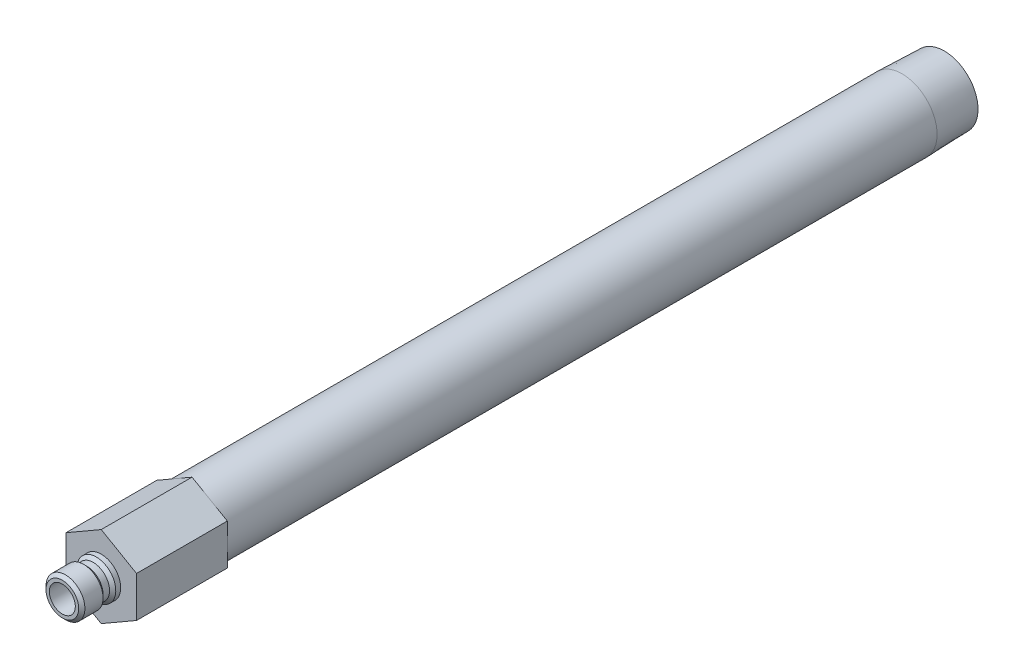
SolidWorks part; units mm, degrees
ref_plane "Front Plane" through (0, 0, 0) normal (0, 0, 1) x (1, 0, 0)
ref_plane "Top Plane" through (0, 0, 0) normal (0, 1, 0) x (1, 0, 0)
ref_plane "Right Plane" through (0, 0, 0) normal (1, 0, 0) x (0, 0, -1)
sketch "Sketch1" plane through (0, 0, 0) normal (1, 0, 0) x (0, 0, -1)
  line L0 (0, 0) -> (-12.7, 0) construction
  line L1 (-9.525, 3.175) -> (-9.525, 4.0005)
  line L2 (-3.556, 4.0005) -> (-3.556, 0) construction
  line L3 (-8.763, 4.7625) -> (-4.318, 4.7625)
  line L4 (0, 8.5725) -> (0, 0) construction
  line L5 (-3.556, 4.0005) -> (-1.9685, 4.0005)
  line L6 (-1.2065, 4.7625) -> (0, 4.7625)
  line L7 (0, 4.7625) -> (0, 8.5725)
  line L8 (-3.556, 4.0005) -> (-4.318, 4.7625)
  line L9 (-1.9685, 4.0005) -> (-1.2065, 4.7625)
  line L10 (-9.525, 4.0005) -> (-8.763, 4.7625)
  line L11 (-9.525, 3.175) -> (22.225, 3.175)
  line L12 (0, 8.5725) -> (196.0372, 8.5725)
  line L13 (196.0372, 8.5725) -> (206.375, 8.2494)
  line L14 (206.375, 8.2494) -> (206.375, 6.2611)
  line L15 (0, 0) -> (22.225, 0) construction
  line L16 (22.225, 0) -> (22.225, 3.175) construction
  line L17 (22.225, 4.7625) -> (0, 4.7625) construction
  line L18 (22.225, 3.175) -> (22.225, 6.2611)
  line L19 (22.225, 6.2611) -> (206.375, 6.2611)
  line L20 (22.225, 3.175) -> (22.225, 4.7625) construction
  dimension "D1" = 9.525
  dimension "D2" = 1.5875
  dimension "D3" = 0.762
  dimension "D4" = 45
  dimension "D5" = 5.969
  dimension "D6" = 45
  dimension "D7" = 1.79
  dimension "D8" = 10.3378
  dimension "D9" = 215.9
  dimension "D10" = 3.175
  dimension "D11" = 31.75
  dimension "D12" = 6.35
  dimension "D13" = 12.5222
  dimension "D14" = 9.525
  dimension "D15" = 17.145
revolve "Revolve1" add sketch "Sketch1" angle 360 about L0
sketch "Sketch2" plane through (0, 0, 0) normal (0, 0, 1) x (1, 0, 0)
  line L1 (-8.636, 4.986) -> (-8.636, -4.986)
  line L2 (-8.636, -4.986) -> (0, -9.972)
  line L3 (0, -9.972) -> (8.636, -4.986)
  line L4 (8.636, -4.986) -> (8.636, 4.986)
  line L5 (8.636, 4.986) -> (0, 9.972)
  line L6 (0, 9.972) -> (-8.636, 4.986)
  circle A0 centre (0, 0) radius 8.636 construction
  circle A1 centre (0, 0) radius 3.175 construction
  circle A2 centre (0, 0) radius 3.175
  dimension "D1" = 17.272
extrude "Boss-Extrude1" add sketch "Sketch2" against normal up to vertex (22.225 mm away) from vertex at 0
